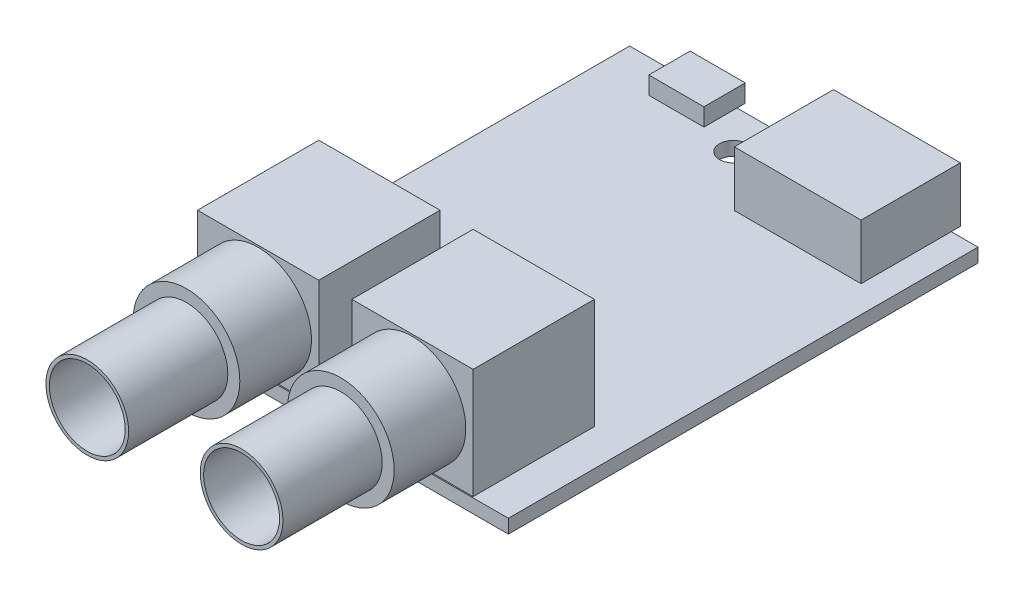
SolidWorks part; units mm, degrees
ref_plane "Front Plane" through (0, 0, 0) normal (0, 0, 1) x (1, 0, 0)
ref_plane "Top Plane" through (0, 0, 0) normal (0, 1, 0) x (1, 0, 0)
ref_plane "Right Plane" through (0, 0, 0) normal (1, 0, 0) x (0, 0, -1)
sketch "Sketch1" plane through (0, 0, 0) normal (0, 1, 0) x (1, 0, 0)
  line L1 (-20.066, -27.051) -> (20.066, -27.051)
  line L2 (-20.066, -27.051) -> (-20.066, 27.051)
  line L3 (-20.066, 27.051) -> (20.066, 27.051)
  line L4 (20.066, -27.051) -> (20.066, 27.051)
  line L5 (-20.066, -27.051) -> (20.066, 27.051) construction
  line L6 (-20.066, 27.051) -> (20.066, -27.051) construction
  point P4 (0, 0)
  dimension "D1" = 40.132
  dimension "D2" = 54.102
extrude "Boss-Extrude1" add sketch "Sketch1" along normal blind 1.5875
sketch "Sketch2" plane through (0, 1.5875, 0) normal (0, 1, 0) x (1, 0, 0)
  line L0 (-20.066, -27.051) -> (20.066, -27.051) construction
  line L1 (-20.066, 27.051) -> (-20.066, -27.051) construction
  circle A0 centre (-3.556, 22.479) radius 1.5875
  circle A1 centre (-0.381, -9.271) radius 1.5875
  dimension "D1" = 3.175
  dimension "D2" = 49.53
  dimension "D3" = 16.51
  dimension "D4" = 17.78
  dimension "D5" = 19.685
extrude "Cut-Extrude1" cut sketch "Sketch2" against normal up to next
sketch "Sketch3" plane through (0, 1.5875, 0) normal (0, 1, 0) x (1, 0, 0)
  line L1 (-14.0448, 23.2352) -> (-7.6948, 23.2352)
  line L2 (-14.0448, 23.2352) -> (-14.0448, 27.9977)
  line L3 (-14.0448, 27.9977) -> (-7.6948, 27.9977)
  line L4 (-7.6948, 23.2352) -> (-7.6948, 27.9977)
  line L5 (-14.0448, 23.2352) -> (-7.6948, 27.9977) construction
  line L6 (-14.0448, 27.9977) -> (-7.6948, 23.2352) construction
  point P4 (-10.8698, 25.6164)
  dimension "D1" = 6.35
  dimension "D2" = 4.7625
extrude "Boss-Extrude2" add sketch "Sketch3" along normal blind 2.032
sketch "Sketch4" plane through (0, 1.5875, 0) normal (0, 1, 0) x (1, 0, 0)
  line L1 (2.3767, 16.6676) -> (16.9817, 16.6676)
  line L2 (2.3767, 16.6676) -> (2.3767, 28.0976)
  line L3 (2.3767, 28.0976) -> (16.9817, 28.0976)
  line L4 (16.9817, 16.6676) -> (16.9817, 28.0976)
  line L5 (2.3767, 16.6676) -> (16.9817, 28.0976) construction
  line L6 (2.3767, 28.0976) -> (16.9817, 16.6676) construction
  point P4 (9.6792, 22.3826)
  dimension "D1" = 14.605
  dimension "D2" = 11.43
extrude "Boss-Extrude3" add sketch "Sketch4" along normal blind 6.35
sketch "Sketch5" plane through (0, 1.5875, 0) normal (0, 1, 0) x (1, 0, 0)
  line L0 (-20.066, -27.051) -> (20.066, -27.051) construction
  line L1 (-15.875, -26.924) -> (-1.905, -26.924)
  line L2 (-15.875, -26.924) -> (-15.875, -12.954)
  line L3 (-15.875, -12.954) -> (-1.905, -12.954)
  line L4 (-1.905, -26.924) -> (-1.905, -12.954)
  line L5 (-15.875, -26.924) -> (-1.905, -12.954) construction
  line L6 (-15.875, -12.954) -> (-1.905, -26.924) construction
  point P4 (-8.89, -19.939)
  dimension "D1" = 0.127
  dimension "D2" = 13.97
  dimension "D3" = 13.97
  dimension "D4" = 8.89
extrude "Boss-Extrude4" add sketch "Sketch5" along normal blind 12.7
sketch "Sketch6" plane through (0, 0, 26.924) normal (0, 0, 1) x (1, 0, 0)
  line L0 (-15.875, 14.2875) -> (-1.905, 14.2875) construction
  line L1 (-15.875, 14.2875) -> (-15.875, 1.5875) construction
  circle A0 centre (-8.89, 7.9375) radius 6.1468
  point P4 (-8.89, 14.2875)
  point P8 (-15.875, 7.9375)
  dimension "D1" = 12.2936
extrude "Boss-Extrude5" add sketch "Sketch6" along normal blind 8.255
sketch "Sketch7" plane through (0, 0, 35.179) normal (0, 0, 1) x (1, 0, 0)
  circle A0 centre (-8.89, 7.9375) radius 4.7625
  dimension "D1" = 9.525
extrude "Boss-Extrude6" add sketch "Sketch7" along normal blind 11.43
sketch "Sketch8" plane through (0, 0, 46.609) normal (0, 0, 1) x (1, 0, 0)
  circle A0 centre (-8.89, 7.9375) radius 4.371
extrude "Cut-Extrude2" cut sketch "Sketch8" against normal blind 12.7
sketch "Sketch9" plane through (0, 0, 33.909) normal (0, 0, 1) x (1, 0, 0)
  circle A0 centre (-8.89, 7.9375) radius 1.1173
extrude "Boss-Extrude7" add sketch "Sketch9" along normal blind 5.08
sketch "Sketch10" plane through (0, 0, 38.989) normal (0, 0, 1) x (1, 0, 0)
  circle A0 centre (-8.89, 7.9375) radius 0.3903
extrude "Cut-Extrude3" cut sketch "Sketch10" against normal blind 5.08
pattern_linear "LPattern1" count 2 spacing 17.78 along (1, 0, 0) of "Boss-Extrude4", "Boss-Extrude5", "Boss-Extrude6", "Cut-Extrude2", "Boss-Extrude7", "Cut-Extrude3"
sketch "Sketch11" plane through (0, 0, 0) normal (0, -1, 0) x (1, 0, 0)
  line L1 (-17.9156, 5.6968) -> (-15.9744, 5.6968)
  line L2 (-17.9156, 5.6968) -> (-17.9156, 9.706)
  line L3 (-17.9156, 9.706) -> (-15.9744, 9.706)
  line L4 (-15.9744, 5.6968) -> (-15.9744, 9.706)
  line L5 (-17.9156, 5.6968) -> (-15.9744, 9.706) construction
  line L6 (-17.9156, 9.706) -> (-15.9744, 5.6968) construction
  line L7 (9.9082, -4.0092) -> (11.8494, -4.0092)
  line L8 (9.9082, -4.0092) -> (9.9082, 0)
  line L9 (9.9082, 0) -> (11.8494, 0)
  line L10 (11.8494, -4.0092) -> (11.8494, 0)
  line L11 (9.9082, -4.0092) -> (11.8494, 0) construction
  line L12 (9.9082, 0) -> (11.8494, -4.0092) construction
  line L13 (13.7906, -4.0092) -> (15.7318, -4.0092)
  line L14 (13.7906, -4.0092) -> (13.7906, 0)
  line L15 (13.7906, 0) -> (15.7318, 0)
  line L16 (15.7318, -4.0092) -> (15.7318, 0)
  line L17 (13.7906, -4.0092) -> (15.7318, 0) construction
  line L18 (13.7906, 0) -> (15.7318, -4.0092) construction
  line L19 (12.9818, 2.4615) -> (14.923, 2.4615)
  line L20 (12.9818, 2.4615) -> (12.9818, 6.4707)
  line L21 (12.9818, 6.4707) -> (14.923, 6.4707)
  line L22 (14.923, 2.4615) -> (14.923, 6.4707)
  line L23 (12.9818, 2.4615) -> (14.923, 6.4707) construction
  line L24 (12.9818, 6.4707) -> (14.923, 2.4615) construction
  line L25 (6.5111, -23.9064) -> (10.5203, -23.9064)
  line L26 (6.5111, -23.9064) -> (6.5111, -21.9652)
  line L27 (6.5111, -21.9652) -> (10.5203, -21.9652)
  line L28 (10.5203, -23.9064) -> (10.5203, -21.9652)
  line L29 (6.5111, -23.9064) -> (10.5203, -21.9652) construction
  line L30 (6.5111, -21.9652) -> (10.5203, -23.9064) construction
  point P4 (-16.945, 7.7014)
  point P9 (10.8788, -2.0046)
  point P14 (14.7612, -2.0046)
  point P19 (13.9524, 4.4661)
  point P24 (8.5157, -22.9358)
extrude "Boss-Extrude8" add sketch "Sketch11" along normal blind 2.54
